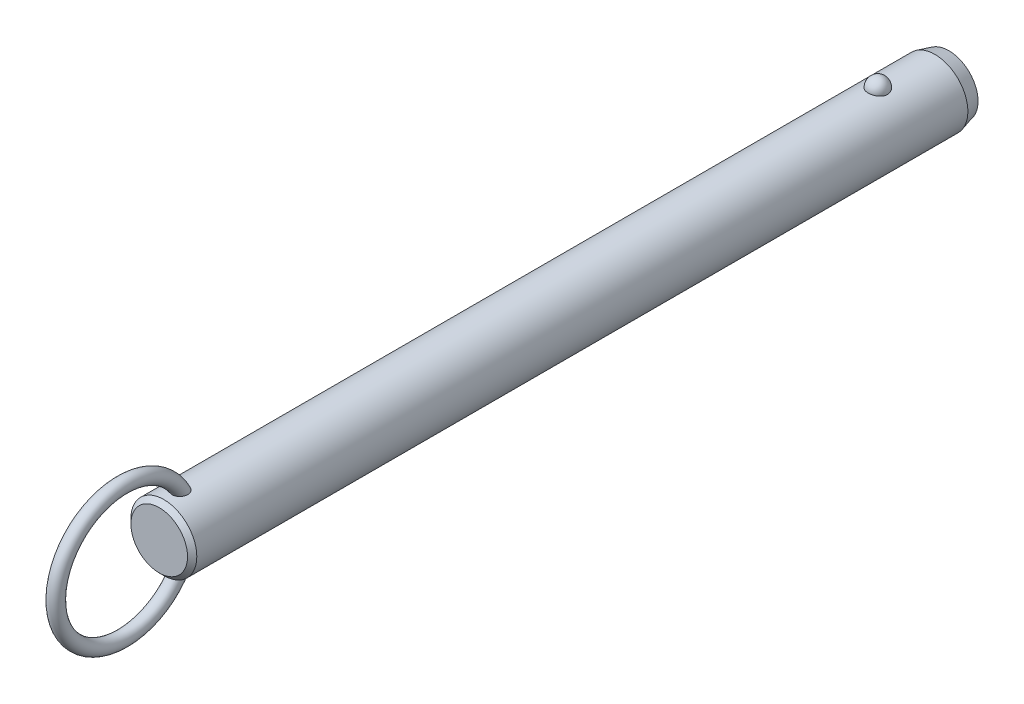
SolidWorks part; units mm, degrees
ref_plane "Front Plane" through (0, 0, 0) normal (0, 0, 1) x (1, 0, 0)
ref_plane "Top Plane" through (0, 0, 0) normal (0, 1, 0) x (1, 0, 0)
ref_plane "Right Plane" through (0, 0, 0) normal (1, 0, 0) x (0, 0, -1)
sketch "Sketch2" plane through (0, 0, 0) normal (0, 0, 1) x (1, 0, 0)
  circle A0 centre (0, 0) radius 7.1
  point P3 (0, 7.1)
  dimension "D1" = 14.2
extrude "Boss-Extrude1" add sketch "Sketch2" along normal blind 144.8
sketch "Sketch3" plane through (0, 0, 0) normal (0, 0, -1) x (-1, 0, 0)
  circle A0 centre (0, 0) radius 7.1
  dimension "D1" = 14.2
extrude "Boss-Extrude2" add sketch "Sketch3" along normal blind 17.4
chamfer "Chamfer1" distance 3 angle 15 1 edges at (-7.1, 0, -17.4)
sketch "Sketch12" plane through (0, 0, 0) normal (1, 0, 0) x (0, 0, -1)
  line L0 (-144.8, 7.1) -> (-144.8, -7.1) construction
  point P0 (-144.8, 0)
sketch "Sketch13" plane through (0, 0, 0) normal (1, 0, 0) x (0, 0, -1)
  circle A0 centre (-160.65, 0) radius 15.85
  point P2 (-144.8, 0)
  dimension "D1" = 31.7
sketch "Sketch14" plane through (0, 0, 0) normal (0, 1, 0) x (1, 0, 0)
  circle A0 centre (0, -146.3) radius 1.5
  point P2 (0, -144.8)
  dimension "D1" = 3
sweep "Sweep1" add profiles "Sketch14" path "Sketch13"
sketch "Sketch15" plane through (0, 0, 144.8) normal (0, 0, 1) x (1, 0, 0)
  circle A0 centre (0, 0) radius 7.1
  dimension "D1" = 14.2
extrude "Boss-Extrude3" add sketch "Sketch15" along normal blind 7.92
chamfer "Chamfer2" distance 1 angle 45 1 edges at (7.1, 0, 152.72)
sketch "Sketch18" plane through (0, 0, 0) normal (1, 0, 0) x (0, 0, -1)
  line L0 (14.4, 7.1) -> (-146.4792, 7.1) construction
  line L1 (2.1, 9.2) -> (2.1, 5)
  line L2 (-146.4792, -7.1) -> (14.4, -7.1) construction
  arc A0 (2.1, 9.2) -> (2.1, 5) centre (2.1, 7.1) ccw
  point P4 (0, 7.1)
  dimension "D1" = 16.3
revolve "Revolve1" add sketch "Sketch18" angle 360 about L1
